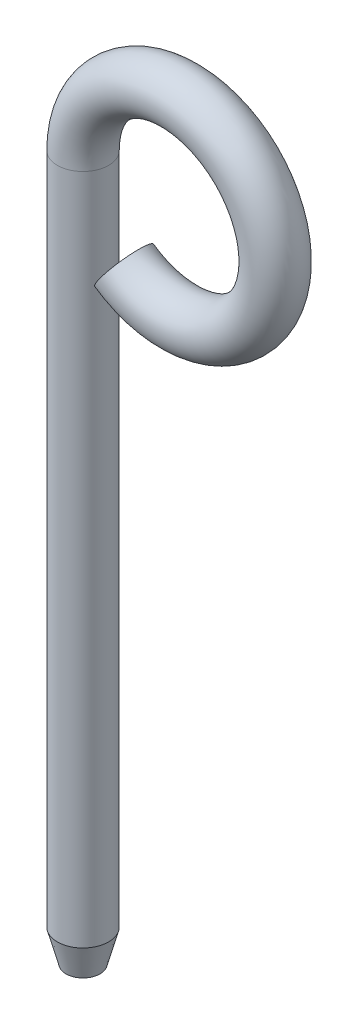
SolidWorks part; units mm, degrees
ref_plane "Face" through (0, 0, 0) normal (0, 0, 1) x (1, 0, 0)
ref_plane "Dessus" through (0, 0, 0) normal (0, 1, 0) x (1, 0, 0)
ref_plane "Droite" through (0, 0, 0) normal (1, 0, 0) x (0, 0, -1)
sketch "Esquisse1" plane through (0, 0, 0) normal (0, 0, 1) x (1, 0, 0)
  line L0 (0, 0) -> (0, 110)
  line L1 (15, 110) -> (6.3964, 97.7127) construction
  arc A0 (0, 110) -> (6.3964, 97.7127) centre (15, 110) cw
  dimension "D1" = 15
  dimension "D2" = 110
  dimension "D3" = 35
sketch "Esquisse2" plane through (0, 0, 0) normal (0, 1, 0) x (1, 0, 0)
  circle A0 centre (0, 0) radius 4
  dimension "D1" = 8
sweep "Balayage1" add profiles "Esquisse2" path "Esquisse1"
chamfer "Chanfrein1" distance 5 angle 15 1 edges at (0, 0, 4)
